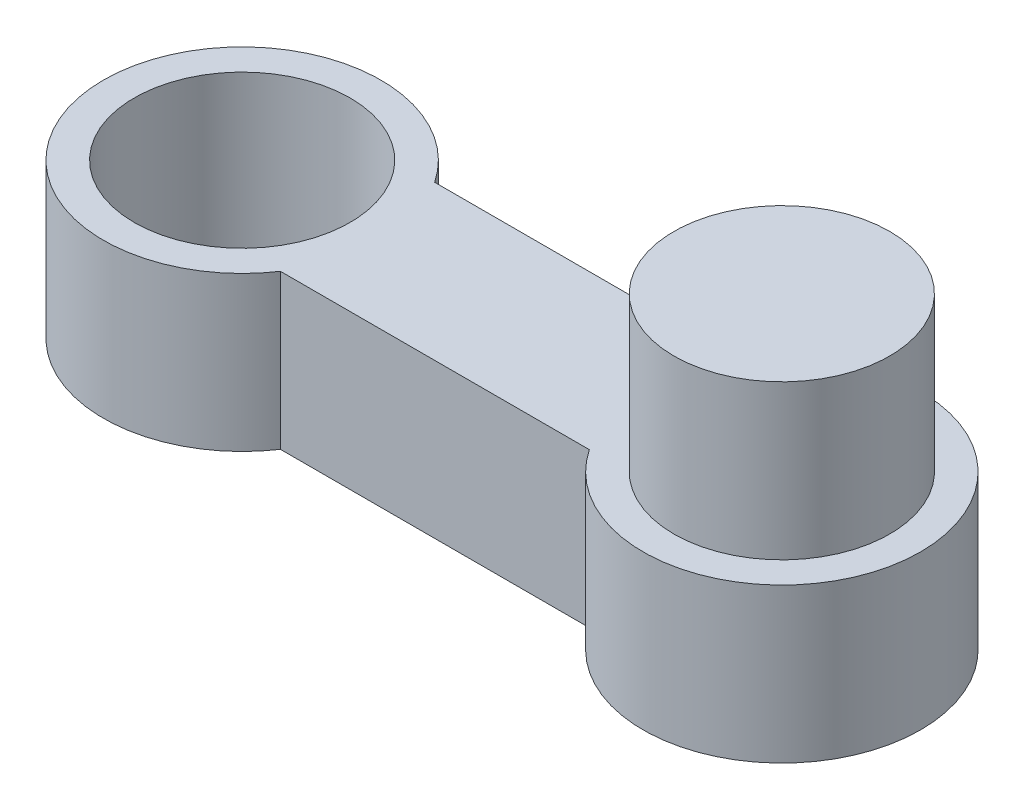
SolidWorks part; units mm, degrees
ref_plane "Front Plane" through (0, 0, 0) normal (0, 0, 1) x (1, 0, 0)
ref_plane "Top Plane" through (0, 0, 0) normal (0, 1, 0) x (1, 0, 0)
ref_plane "Right Plane" through (0, 0, 0) normal (1, 0, 0) x (0, 0, -1)
sketch "Sketch1" plane through (0, 0, 0) normal (0, 1, 0) x (1, 0, 0)
  line L0 (-242.6257, 275.7418) -> (-242.6257, 275.9924)
  line L1 (-242.6257, 175.9924) -> (-42.6257, 175.9924)
  line L2 (-242.6257, 175.9924) -> (-242.6257, 176.2431)
  line L3 (-242.6257, 275.9924) -> (-42.6257, 275.9924)
  line L4 (-42.6257, 175.9924) -> (-42.6257, 176.2431)
  line L5 (-42.6257, 275.7418) -> (-42.6257, 275.9924)
  arc A0 (-242.6257, 275.7418) -> (-242.6257, 176.2431) centre (-317.6257, 225.9924) ccw
  arc A1 (-42.6257, 176.2431) -> (-42.6257, 275.7418) centre (32.3743, 225.9924) ccw
  dimension "D3" = 180
  dimension "D6" = 180
  dimension "D1" = 200
  dimension "D2" = 100
  dimension "D4" = 50
  dimension "D5" = 75
  dimension "D7" = 75
  dimension "D8" = 50
extrude "Boss-Extrude1" add sketch "Sketch1" along normal blind 100
sketch "Sketch2" plane through (0, 100, 0) normal (0, 1, 0) x (1, 0, 0)
  circle A0 centre (-317.6257, 225.9924) radius 70
  dimension "D1" = 140
extrude "Cut-Extrude1" cut sketch "Sketch2" against normal blind 100
sketch "Sketch3" plane through (0, 100, 0) normal (0, 1, 0) x (1, 0, 0)
  circle A0 centre (32.3743, 225.9924) radius 70
  dimension "D1" = 140
extrude "Boss-Extrude2" add sketch "Sketch3" along normal blind 100
